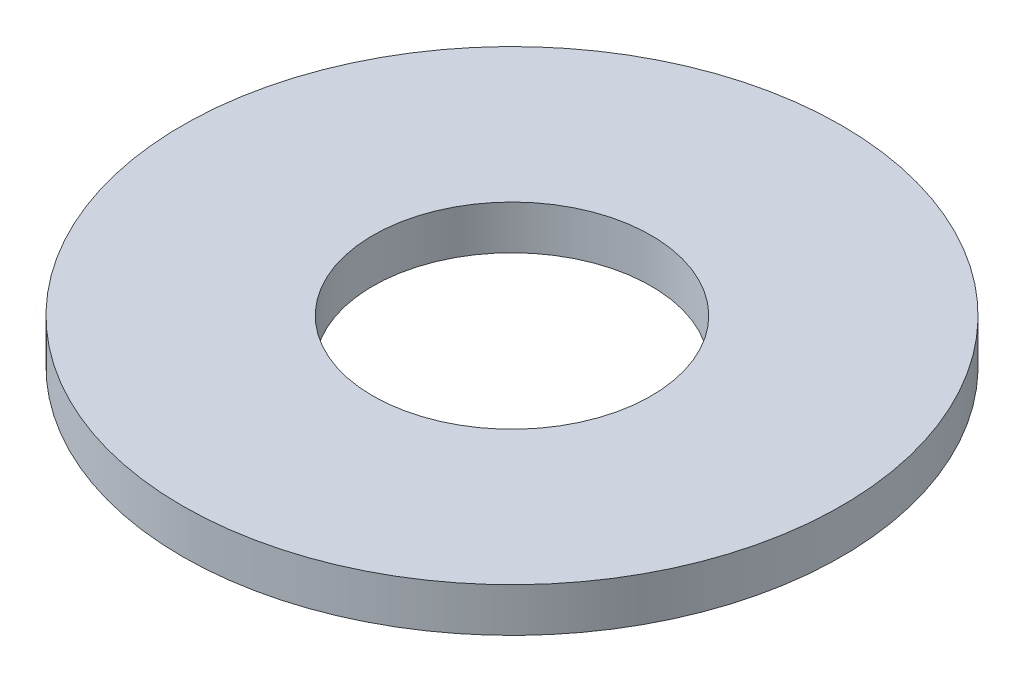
SolidWorks part; units mm, degrees
ref_plane "Plan de face" through (0, 0, 0) normal (0, 0, 1) x (1, 0, 0)
ref_plane "Plan de dessus" through (0, 0, 0) normal (0, 1, 0) x (1, 0, 0)
ref_plane "Plan de droite" through (0, 0, 0) normal (1, 0, 0) x (0, 0, -1)
sketch "Esquisse1" plane through (0, 0, 0) normal (0, 1, 0) x (1, 0, 0)
  circle A0 centre (0, 0) radius 2.25
  circle A1 centre (0, 0) radius 0.95
extrude "Extrusion1" add sketch "Esquisse1" along normal blind 0.3
